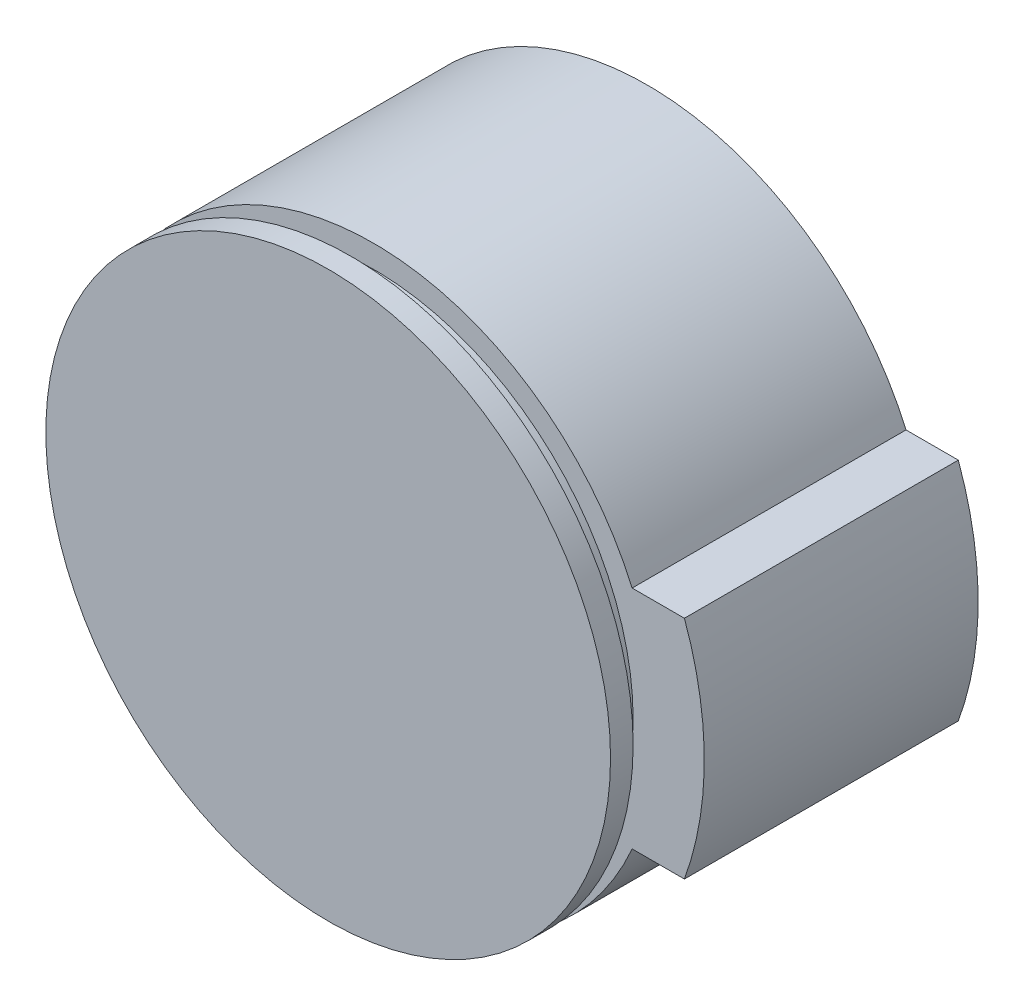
SolidWorks part; units mm, degrees
ref_plane "Front" through (0, 0, 0) normal (0, 0, 1) x (1, 0, 0)
ref_plane "Top" through (0, 0, 0) normal (0, 1, 0) x (1, 0, 0)
ref_plane "Right" through (0, 0, 0) normal (1, 0, 0) x (0, 0, -1)
sketch "Sketch1" plane through (0, 0, 0) normal (1, 0, 0) x (0, 0, -1)
  line L0 (0, 0) -> (0, 25)
  line L1 (0, 25) -> (-24.25, 25)
  line L2 (-24.25, 25) -> (-24.25, 23)
  line L3 (-24.25, 23) -> (-26.25, 23)
  line L4 (-26.25, 23) -> (-26.25, 25)
  line L5 (-26.25, 25) -> (-28.25, 25)
  line L6 (-28.25, 25) -> (-28.25, 0)
  line L7 (-28.25, 0) -> (0, 0)
  dimension "D1" = 25
  dimension "D2" = 2
  dimension "D3" = 28.25
revolve "Revolve1" add sketch "Sketch1" angle 360 about L7
sketch "Sketch3" plane through (0, 0, 24.25) normal (0, 0, 1) x (1, 0, 0)
  line L0 (0, 0) -> (14.415, 0) construction
  line L1 (22.9129, 10) -> (27.5407, 10)
  line L3 (22.9129, -10) -> (27.5407, -10)
  arc A0 (27.5407, -10) -> (27.5407, 10) centre (0, 0) ccw
  circle A1 centre (0, 0) radius 25 construction
  arc A2 (22.9129, -10) -> (22.9129, 10) centre (0, 0) ccw
  dimension "D1" = 58.6
  dimension "D2" = 20
extrude "Extrude4" add sketch "Sketch3" against normal up to surface (24.25 mm away)
